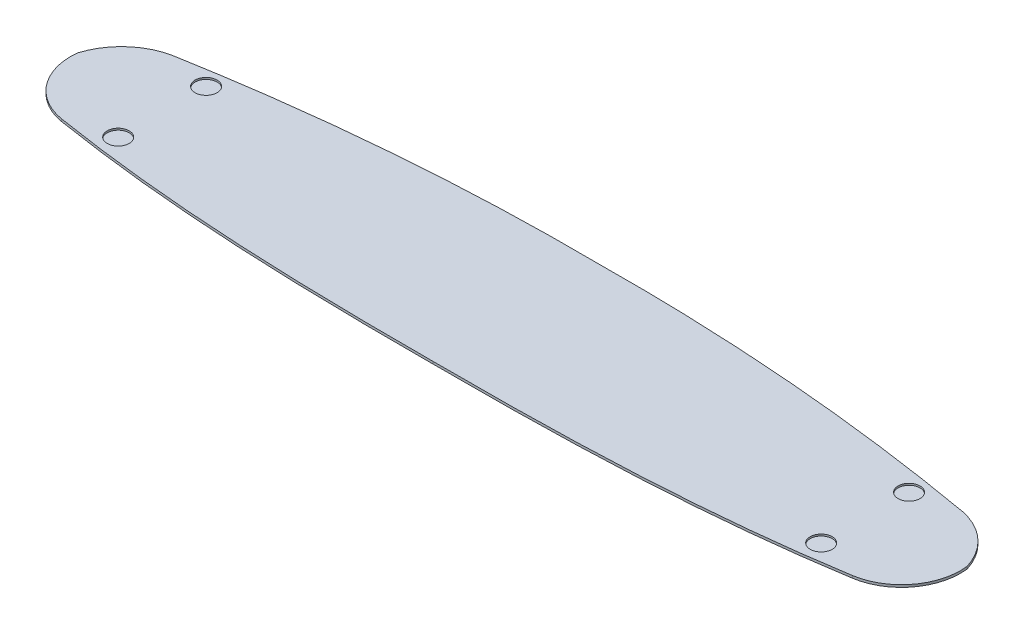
SolidWorks part; units mm, degrees
ref_plane "Front Plane" through (0, 0, 0) normal (0, 0, 1) x (1, 0, 0)
ref_plane "Top Plane" through (0, 0, 0) normal (0, 1, 0) x (1, 0, 0)
ref_plane "Right Plane" through (0, 0, 0) normal (1, 0, 0) x (0, 0, -1)
sketch "Sketch1" plane through (0, 0, 0) normal (0, 1, 0) x (1, 0, 0)
  line L0 (0, 0) -> (0, -126.5094) construction
  arc A0 (203.2, -73.4387) -> (228.5027, -39.91) centre (198.3602, -43.4745) ccw
  arc A1 (228.5027, -39.91) -> (203.2, -16.7455) centre (196.2586, -49.729) ccw
  arc A2 (-203.2, -73.4387) -> (-228.5027, -39.91) centre (-198.3602, -43.4745) cw
  arc A3 (-228.5027, -39.91) -> (-203.2, -16.7455) centre (-196.2586, -49.729) cw
  spline S0 degree 3 poles (0, -85.9119) (67.8826, -86.1303) (136.0004, -84.2927) (203.2, -73.4387) knots 0 0 0 0 1 1 1 1
  spline S1 degree 2 poles (203.2, -16.7455) (102.4142, 1.1102) (0, 0) knots 0 0 0 1 1 1
  spline S2 degree 3 poles (0, -85.9119) (-67.8826, -86.1303) (-136.0004, -84.2927) (-203.2, -73.4387) knots 0 0 0 0 1 1 1 1
  spline S3 degree 2 poles (-203.2, -16.7455) (-102.4142, 1.1102) (0, 0) knots 0 0 0 1 1 1
  dimension "D1" = 203.2
base flange "Base-Flange1" sketch "Sketch1" thickness 1.2192 reverse thickness direction no parameters "D1"=0.7366
scale "Scale1" scale about centroid uniform scaling yes scale factor 0.28125
sketch "Sketch2" plane through (0, -0.4381, 0) normal (0, 1, 0) x (1, 0, 0)
  line L0 (0, -31.5069) -> (0, -55.6696) construction
  line L1 (64.2664, -42.7315) -> (-64.2664, -42.7315) construction
  circle A0 centre (50.8, -50.3515) radius 1.5875
  circle A1 centre (50.8, -37.6515) radius 1.5875
  circle A2 centre (-50.8, -37.6515) radius 1.5875
  circle A3 centre (-50.8, -50.3515) radius 1.5875
  dimension "D1" = 3.175
  dimension "D3" = 3.175
  dimension "D2" = 7.62
  dimension "D4" = 5.08
  dimension "D5" = 50.8
extrude "Cut-Extrude2" cut sketch "Sketch2" against normal blind 0.254
sketch "Bend-Lines1" [suppressed] plane through (0, 0, 0) normal (0, 1, 0) x (1, 0, 0)
sketch "Bounding-Box1" [suppressed] plane through (0, 0, 0) normal (0, 1, 0) x (1, 0, 0)
sheet metal parameters "Sheet-Metal1" thickness 1.2192 parameters "D1"=0.7366
flat pattern "Flat-Pattern1"
sketch "Bend-Lines2" plane through (0, 0, 0) normal (0, 1, 0) x (1, 0, 0)
sketch3d "Bounding-Box2" [suppressed]
  line L0 (126.706, -82.295, 0) -> (-330.7195, -82.2989, 0) construction
  line L1 (126.7052, 3.6981, 0) -> (-330.7202, 3.6943, 0) construction
  line L2 (126.706, -82.295, 0) -> (126.7052, 3.6981, 0) construction
  line L3 (-330.7195, -82.2989, 0) -> (-330.7202, 3.6943, 0) construction
sheet metal parameters "Sheet-Metal2" thickness 1.2192 parameters "D1"=0.7366
flat pattern "Flat-Pattern1"
sketch "Bend-Lines2" plane through (0, 0, 0) normal (0, 1, 0) x (1, 0, 0)
sketch3d "Bounding-Box2" [suppressed]
  line L0 (126.706, -82.295, 0) -> (-330.7195, -82.2989, 0) construction
  line L1 (126.7052, 3.6981, 0) -> (-330.7202, 3.6943, 0) construction
  line L2 (126.706, -82.295, 0) -> (126.7052, 3.6981, 0) construction
  line L3 (-330.7195, -82.2989, 0) -> (-330.7202, 3.6943, 0) construction
sheet metal parameters "Sheet-Metal4" thickness 1.2192 parameters "D1"=0.7366
flat pattern "Flat-Pattern1"
sketch "Bend-Lines2" plane through (0, 0, 0) normal (0, 1, 0) x (1, 0, 0)
sketch3d "Bounding-Box2" [suppressed]
  line L0 (126.706, -82.295, 0) -> (-330.7195, -82.2989, 0) construction
  line L1 (126.7052, 3.6981, 0) -> (-330.7202, 3.6943, 0) construction
  line L2 (126.706, -82.295, 0) -> (126.7052, 3.6981, 0) construction
  line L3 (-330.7195, -82.2989, 0) -> (-330.7202, 3.6943, 0) construction
